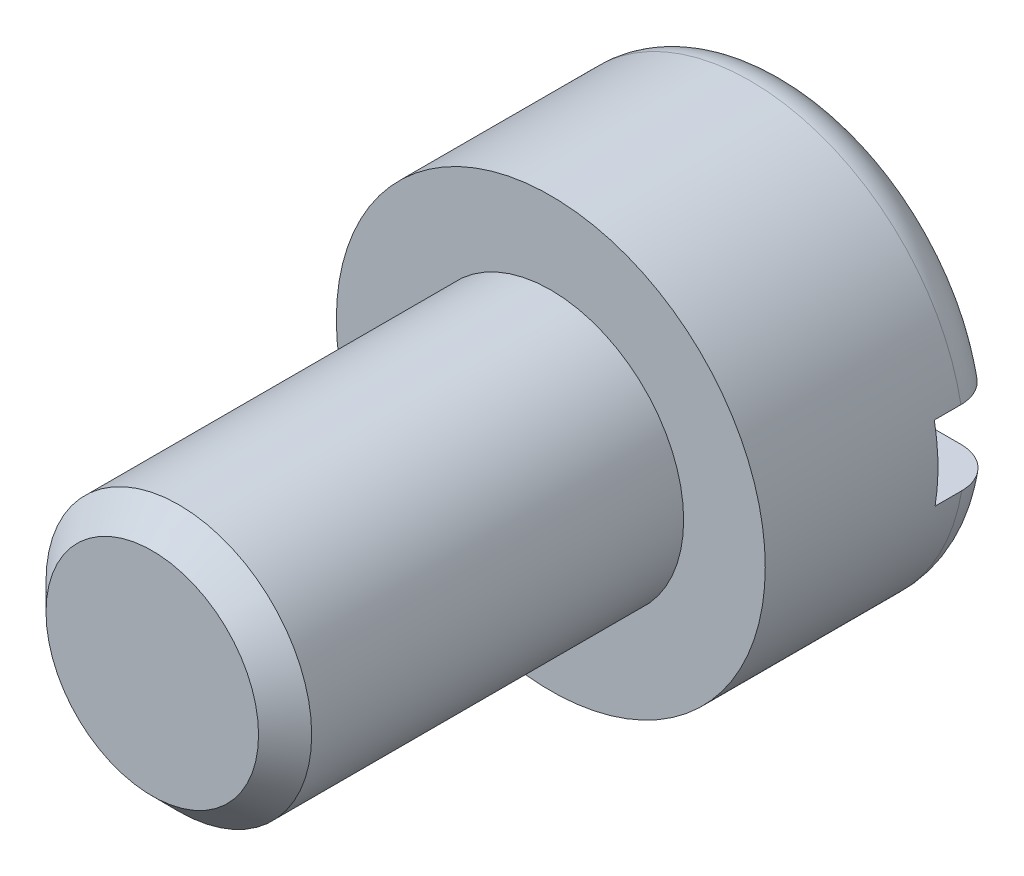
SolidWorks part; units mm, degrees
ref_plane "Plan de face" through (0, 0, 0) normal (0, 0, 1) x (1, 0, 0)
ref_plane "Plan de dessus" through (0, 0, 0) normal (0, 1, 0) x (1, 0, 0)
ref_plane "Plan de droite" through (0, 0, 0) normal (1, 0, 0) x (0, 0, -1)
sketch "Esquisse1" plane through (0, 0, 0) normal (0, 0, 1) x (1, 0, 0)
  circle A0 centre (0, 0) radius 1
extrude "Extrusion1" add sketch "Esquisse1" along normal blind 3
chamfer "Chanfrein1" distance 0.2 angle 45 1 edges at (1, 0, 3)
sketch "Esquisse2" plane through (0, 0, 0) normal (0, 0, -1) x (-1, 0, 0)
  circle A0 centre (0, 0) radius 1.6144
extrude "Extrusion2" add sketch "Esquisse2" along normal blind 1.8
fillet "Congé1" radius 0.3 1 edges at (-1.6144, 0, -1.8)
sketch "Esquisse3" plane through (0, 0, -1.8) normal (0, 0, -1) x (-1, 0, 0)
  line L1 (-2.1006, 0.2954) -> (2.0162, 0.2954)
  line L2 (-2.1006, 0.2954) -> (-2.1006, -0.263)
  line L3 (-2.1006, -0.263) -> (2.0162, -0.263)
  line L4 (2.0162, 0.2954) -> (2.0162, -0.263)
extrude "Enlèv. mat.-Extru.1" cut sketch "Esquisse3" against normal blind 0.5
